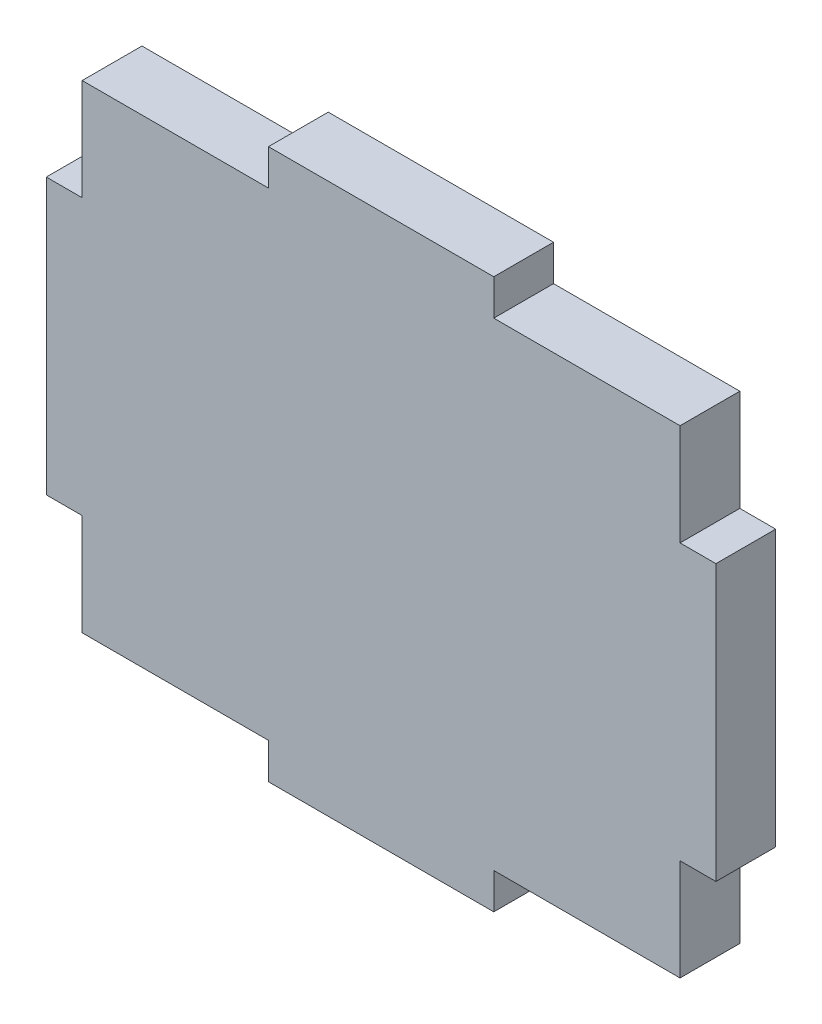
SolidWorks part; units mm, degrees
ref_plane "Front Plane" through (0, 0, 0) normal (0, 0, 1) x (1, 0, 0)
ref_plane "Top Plane" through (0, 0, 0) normal (0, 1, 0) x (1, 0, 0)
ref_plane "Right Plane" through (0, 0, 0) normal (1, 0, 0) x (0, 0, -1)
sketch "Sketch1" plane through (0, 0, 0) normal (0, 0, 1) x (1, 0, 0)
  line L0 (-64.7494, 0) -> (64.8833, 0) construction
  line L1 (-50, -40) -> (-18.8424, -40)
  line L2 (-50, -40) -> (-50, -23.0204)
  line L3 (-50, 40) -> (-18.8424, 40)
  line L4 (50, -40) -> (50, -23.0204)
  line L5 (-50, -40) -> (50, 40) construction
  line L6 (-50, 40) -> (50, -40) construction
  line L7 (0, 71.3469) -> (0, -54.0408) construction
  line L8 (-50, 23.0204) -> (-50, 40)
  line L9 (-56, -23.0204) -> (-50, -23.0204)
  line L10 (-56, -23.0204) -> (-56, 23.0204)
  line L11 (-56, 23.0204) -> (-50, 23.0204)
  line L12 (18.8424, 40) -> (50, 40)
  line L13 (-56, -23.0204) -> (-44, 23.0204) construction
  line L14 (-56, 23.0204) -> (-44, -23.0204) construction
  line L15 (18.8424, -40) -> (18.8424, -46)
  line L16 (-18.8424, 40) -> (-18.8424, 46)
  line L17 (-18.8424, 46) -> (18.8424, 46)
  line L18 (18.8424, 40) -> (18.8424, 46)
  line L19 (-18.8424, 34) -> (18.8424, 46) construction
  line L20 (-18.8424, 46) -> (18.8424, 34) construction
  line L21 (-18.8424, -40) -> (-18.8424, -46)
  line L22 (-18.8424, -46) -> (18.8424, -46)
  line L23 (56, -23.0204) -> (50, -23.0204)
  line L24 (56, -23.0204) -> (56, 23.0204)
  line L25 (56, 23.0204) -> (50, 23.0204)
  line L26 (18.8424, -40) -> (50, -40)
  line L27 (50, 23.0204) -> (50, 40)
  point P0 (0, 0)
  point P10 (-50, 0)
  point P15 (0, 40)
  dimension "D1" = 80
  dimension "D2" = 100
  dimension "D3" = 12
  dimension "D4" = 12
extrude "Boss-Extrude1" add sketch "Sketch1" along normal blind 10
